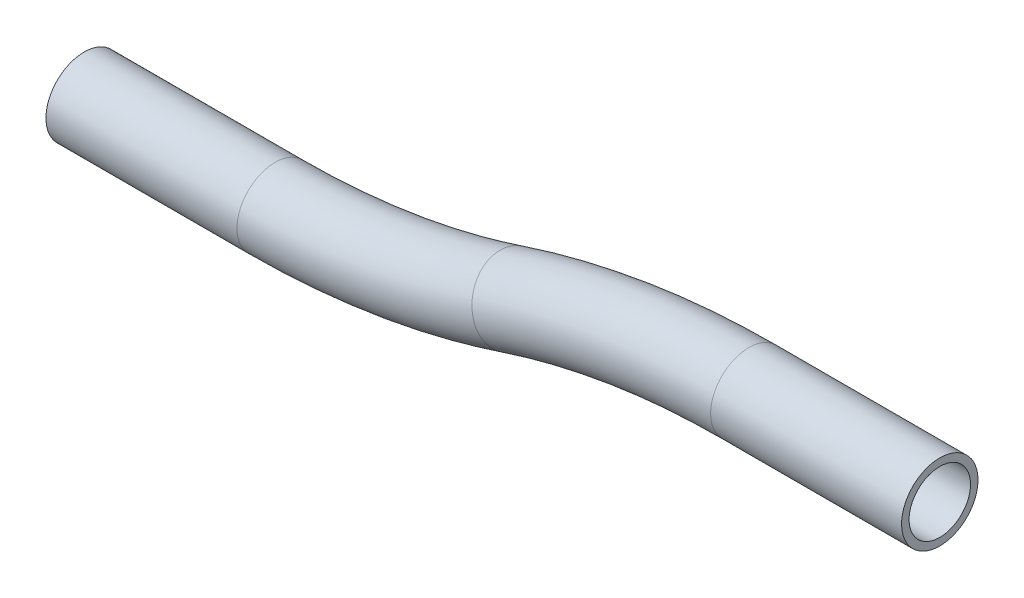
SolidWorks part; units mm, degrees
ref_plane "Front Plane" through (0, 0, 0) normal (0, 0, 1) x (1, 0, 0)
ref_plane "Top Plane" through (0, 0, 0) normal (0, 1, 0) x (1, 0, 0)
ref_plane "Right Plane" through (0, 0, 0) normal (1, 0, 0) x (0, 0, -1)
sketch "Sketch1" plane through (0, 0, 0) normal (1, 0, 0) x (0, 0, -1)
  circle A0 centre (0, 0) radius 5.1054
  circle A1 centre (0, 0) radius 6.35
  dimension "D1" = 12.7
  dimension "D2" = 10.2108
sketch "Sketch2" plane through (0, 0, 0) normal (0, 0, 1) x (1, 0, 0)
  line L0 (0, 0) -> (31.75, 0)
  line L1 (110.49, 12.7) -> (142.24, 12.7)
  arc A0 (31.75, 0) -> (71.12, 6.35) centre (31.75, 125.222) ccw
  arc A1 (71.12, 6.35) -> (110.49, 12.7) centre (110.49, -112.522) cw
  dimension "D3" = 125.222
  dimension "D1" = 31.75
  dimension "D2" = 12.7
  dimension "D4" = 142.24
sweep "Sweep1" add profiles "Sketch1" path "Sketch2"
